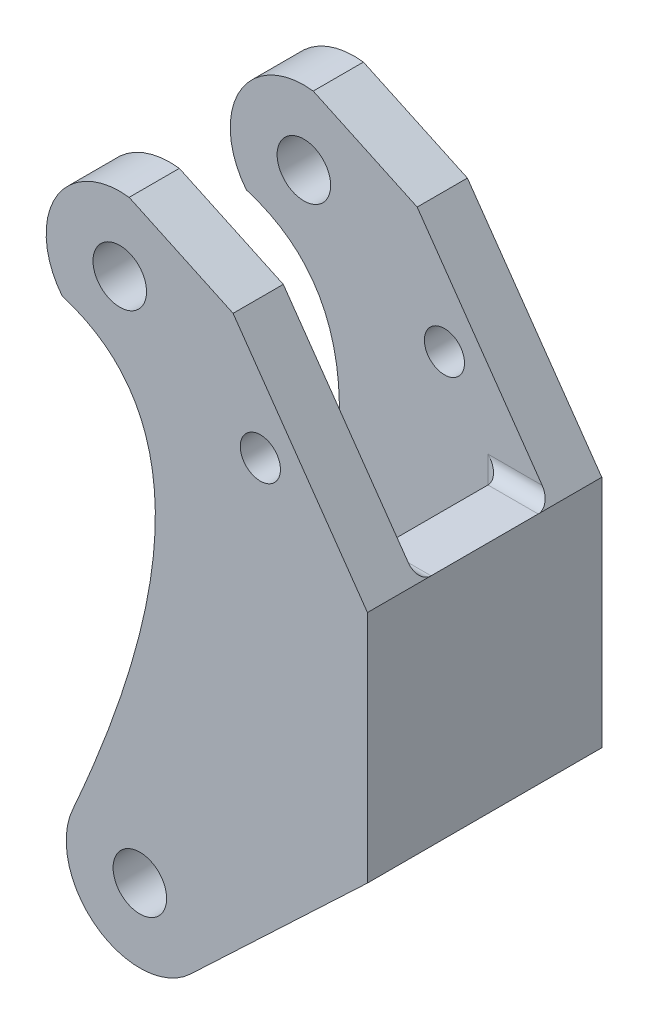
SolidWorks part; units mm, degrees
ref_plane "Plan de face" through (0, 0, 0) normal (0, 0, 1) x (1, 0, 0)
ref_plane "Plan de dessus" through (0, 0, 0) normal (0, 1, 0) x (1, 0, 0)
ref_plane "Plan de droite" through (0, 0, 0) normal (1, 0, 0) x (0, 0, -1)
sketch "Esquisse1" plane through (0, 0, 0) normal (0, 0, 1) x (1, 0, 0)
  line L0 (0, 0) -> (0, 35)
  line L1 (0, 35) -> (-20.0752, 63.6703)
  line L2 (0, 0) -> (-26.4441, -24.9942)
  line L3 (-34, 16.6729) -> (-34, -64.9961) construction
  line L5 (-20.0752, 63.6703) -> (-35.6026, 70.9109)
  line L6 (-37, 101.1678) -> (-37, 38.7151) construction
  arc A0 (-44.0335, -12.4912) -> (-26.4441, -24.9942) centre (-34, -17) ccw
  arc A1 (-35.6026, 70.9109) -> (-45.5921, 53.1316) centre (-37, 60) ccw
  parabola Q0
  point P24 (-44.0335, -12.4912)
  dimension "D7" = 22
  dimension "D10" = 22
  dimension "D1" = 35
  dimension "D2" = 35
  dimension "D3" = 35
  dimension "D4" = 37
  dimension "D5" = 34
  dimension "D6" = 17
  dimension "D8" = 30
  dimension "D9" = 77
extrude "Extrusion1" add sketch "Esquisse1" along normal blind 35
sketch "Esquisse3" plane through (0, 0, 0) normal (1, 0, 0) x (0, 0, -1)
  line L0 (-35, 35) -> (0, 35) construction
  line L1 (-27.5, 35) -> (-7.5, 35)
  line L2 (-27.5, 35) -> (-27.5, 74.7723)
  line L3 (-27.5, 74.7723) -> (-7.5, 74.7723)
  line L4 (-7.5, 35) -> (-7.5, 74.7723)
  line L5 (-35, 35) -> (-35, 63.6703) construction
  line L7 (-35, 0) -> (0, 0) construction
  line L8 (-27.5, 0) -> (-7.5, 0)
  line L9 (-27.5, 0) -> (-27.5, -28.5959)
  line L10 (-27.5, -28.5959) -> (-7.5, -28.5959)
  line L11 (-7.5, 0) -> (-7.5, -28.5959)
  dimension "D1" = 20
  dimension "D2" = 7.5
extrude "Enlèv. mat.-Extru.1" cut sketch "Esquisse3" against normal through all
sketch "Esquisse4" plane through (0, 0, 0) normal (0, -1, 0) x (1, 0, 0)
  line L0 (-45, 27.5) -> (-26.4441, 27.5) construction
  line L1 (-41.2347, 27.5) -> (-7.5, 27.5)
  line L2 (-41.2347, 27.5) -> (-41.2347, 7.5)
  line L3 (-41.2347, 7.5) -> (-7.5, 7.5)
  line L4 (-7.5, 27.5) -> (-7.5, 7.5)
  line L5 (-38.8976, 7.5) -> (0, 7.5) construction
  line L6 (0, 7.5) -> (0, 27.5) construction
  dimension "D1" = 7.5
extrude "Enlèv. mat.-Extru.2" cut sketch "Esquisse4" against normal through all
sketch "Esquisse5" plane through (0, 0, 0) normal (0, 0, -1) x (-1, 0, 0)
  circle A0 centre (37, 60) radius 4
  circle A1 centre (34, -17) radius 4
  arc A3 (45.5921, 53.1316) -> (35.6026, 70.9109) centre (37, 60) ccw construction
  dimension "D1" = 8
  dimension "D2" = 8
extrude "Enlèv. mat.-Extru.3" cut sketch "Esquisse5" against normal through all
fillet "Congé1" radius 2 6 edges at (-3.75, 35, 27.5) (-7.5, 17.5, 27.5) (-3.75, 0, 27.5) (-3.75, 0, 7.5) (-3.75, 35, 7.5) (-7.5, 17.5, 7.5)
sketch "Esquisse6" plane through (0, 0, 35) normal (0, 0, 1) x (1, 0, 0)
  line L0 (-16, 70.5969) -> (-16, -18.8141) construction
  line L1 (0, 0) -> (0, 35) construction
  line L2 (-29.8312, 47) -> (-0.8914, 47) construction
  circle A0 centre (-16, 47) radius 3
  dimension "D3" = 6
  dimension "D1" = 16
  dimension "D2" = 12
extrude "Enlèv. mat.-Extru.4" cut sketch "Esquisse6" against normal through all
ref_plane "Plan2" through (-37, 0, 0) normal (1, 0, 0) x (0, 0, -1)
sketch "Esquisse7" plane through (0, 0, 0) normal (0.6869, -0.7267, 0) x (0.7267, 0.6869, 0)
  line L0 (-36.3868, 7.5) -> (-36.3868, 0) construction
  circle A0 centre (-36.3868, 3.75) radius 2.5
extrude "Extrusion2" cut sketch "Esquisse7" against normal up to next
